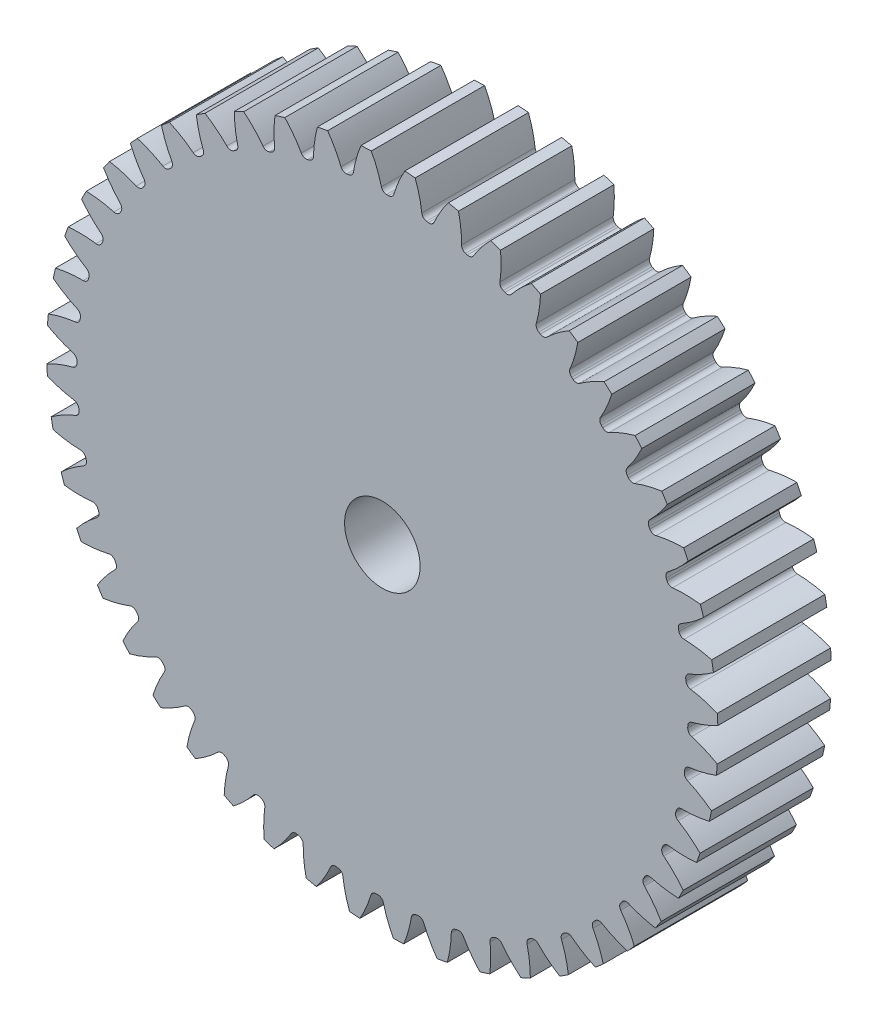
SolidWorks part; units mm, degrees
ref_plane "Front" through (0, 0, 0) normal (0, 0, 1) x (1, 0, 0)
ref_plane "Top" through (0, 0, 0) normal (0, 1, 0) x (1, 0, 0)
ref_plane "Right" through (0, 0, 0) normal (1, 0, 0) x (0, 0, -1)
sketch "Sketch3" plane through (0, 0, 0) normal (0, 0, 1) x (1, 0, 0)
  circle A0 centre (0, 0) radius 282.2222
  dimension "od" = 564.4444
extrude "gearBody" add sketch "Sketch3" along normal blind 95.25
sketch "Sketch2" plane through (0, 0, 0) normal (0, 0, 1) x (1, 0, 0)
  line L0 (0, 0) -> (235.2142, 97.4289) construction
  line L1 (281.7388, -18.9905) -> (0, 0) construction
  line L2 (0, 0) -> (36.3143, 0) construction
  line L3 (270.9005, 4.2171) -> (270.5996, -13.4426) construction
  line L5 (270.7501, -4.6128) -> (0, 0) construction
  line L7 (0, 0) -> (254.5941, 0) construction
  arc A0 (254.5936, -0.4812) -> (254.4622, -8.1915) centre (0, 0) ccw construction
  arc A1 (282.0689, 9.3007) -> (281.5884, -18.9037) centre (0, 0) ccw construction
  arc A2 (270.9005, 4.2171) -> (270.5996, -13.4426) centre (0, 0) ccw construction
  arc A3 (256.7701, -5.1733) -> (256.7973, -3.5763) centre (0, 0) ccw
  arc A4 (281.7388, -18.9905) -> (260.0609, -9.6719) centre (231.7589, -105.3847) ccw
  arc A5 (281.7388, -18.9905) -> (282.2222, 9.3823) centre (0, 0) ccw
  arc A6 (282.2222, 9.3823) -> (260.2395, 0.8075) centre (235.2142, 97.4289) cw
  arc A7 (256.7973, -3.5763) -> (260.2395, 0.8075) centre (261.3915, -3.6403) cw
  arc A8 (260.0609, -9.6719) -> (256.7701, -5.1733) centre (261.3638, -5.2659) cw
  point P6 (282.2222, 9.3823)
  point P22 (281.7388, -18.9905)
  dimension "baseDia" = 509.1881
  dimension "od" = 564.4444
  dimension "pd" = 541.8667
  dimension "rd" = 513.6444
  dimension "rFillet" = 4.5946
  dimension "pointX" = 282.2222
  dimension "pointY" = 9.3823
  dimension "CTT" = 17.6597
  dimension "flankCenterAngle" = 22.5
extrude "toothCut" cut sketch "Sketch2" along normal through all
pattern_circular "CirPattern1" count 48 over 360 about axis through (0, 0, 0) along (0, 0, 1) of "toothCut"
sketch "hub1Dia" plane through (0, 0, 0) normal (0, 0, -1) x (-1, 0, 0)
  circle A0 centre (0, 0) radius 12.7
  dimension "hub1Dia" = 25.4
sketch "hub2Dia" plane through (0, 0, 95.25) normal (0, 0, 1) x (1, 0, 0)
  circle A0 centre (0, 0) radius 12.7
  dimension "hub2dia" = 25.4
sketch "boreDia" plane through (0, 0, 0) normal (0, 0, 1) x (1, 0, 0)
  circle A0 centre (0, 0) radius 31.75
  dimension "boreDia" = 63.5
extrude "bore" cut sketch "boreDia" against normal mid plane 25400
